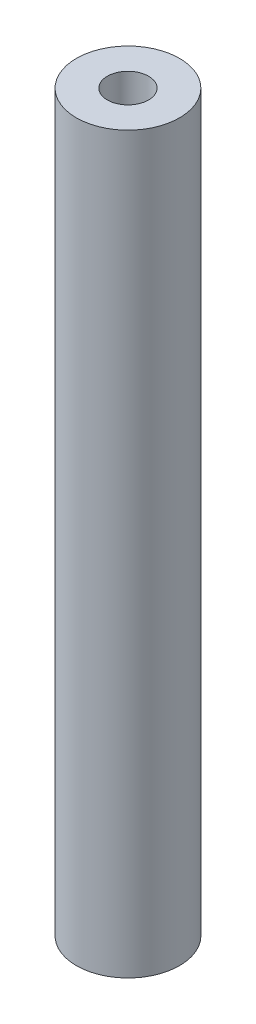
SolidWorks part; units mm, degrees
ref_plane "前视基准面" through (0, 0, 0) normal (0, 0, 1) x (1, 0, 0)
ref_plane "上视基准面" through (0, 0, 0) normal (0, 1, 0) x (1, 0, 0)
ref_plane "右视基准面" through (0, 0, 0) normal (1, 0, 0) x (0, 0, -1)
sketch "草图1" plane through (0, 0, 0) normal (0, 1, 0) x (1, 0, 0)
  circle A0 centre (0, 0) radius 6.25
  dimension "D1" = 12.5
extrude "凸台-拉伸1" add sketch "草图1" along normal blind 89
sketch "草图2" plane through (0, 89, 0) normal (0, 1, 0) x (1, 0, 0)
  circle A0 centre (0, 0) radius 2.5
  circle A1 centre (0, 0) radius 6.25 construction
  dimension "D1" = 5
extrude "切除-拉伸1" cut sketch "草图2" against normal blind 10
sketch "草图17" plane through (0, 0, 0) normal (0, -1, 0) x (1, 0, 0)
  circle A0 centre (0, 0) radius 2.5
  dimension "D1" = 5
extrude "切除-拉伸2" cut sketch "草图17" against normal blind 10
